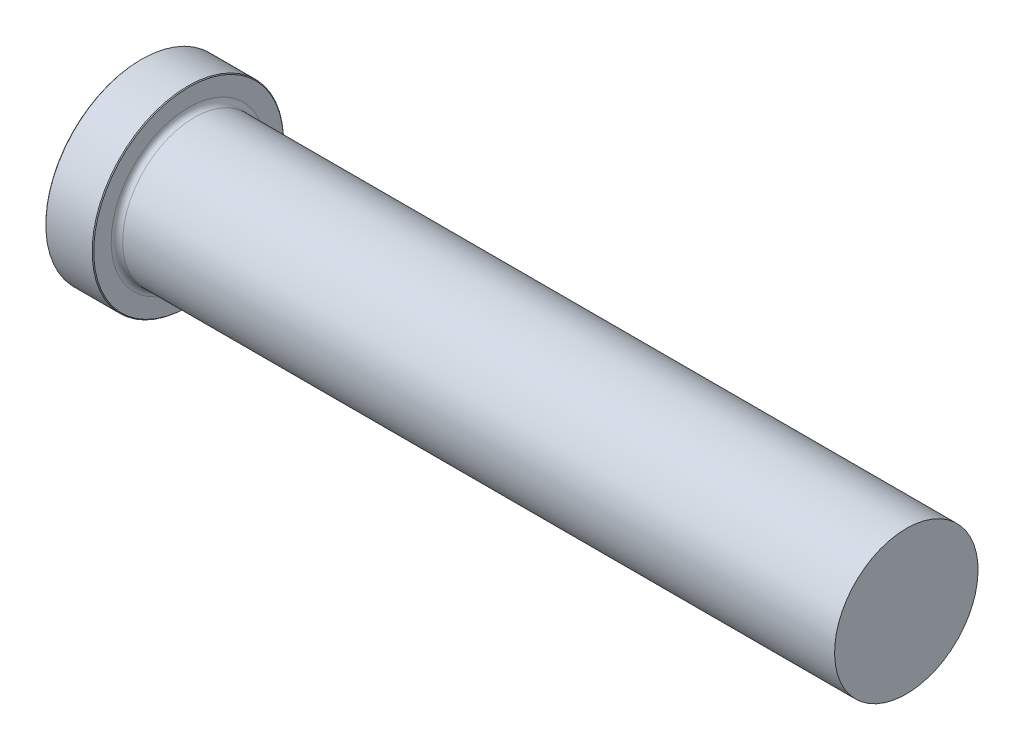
SolidWorks part; units mm, degrees
ref_plane "Front Plane" through (0, 0, 0) normal (0, 0, 1) x (1, 0, 0)
ref_plane "Top Plane" through (0, 0, 0) normal (0, 1, 0) x (1, 0, 0)
ref_plane "Right Plane" through (0, 0, 0) normal (1, 0, 0) x (0, 0, -1)
sketch "Sketch1" plane through (0, 0, 0) normal (0, 0, 1) x (1, 0, 0)
  line L0 (0, 0) -> (0, 12.7)
  line L1 (0, 12.7) -> (6.35, 12.7)
  line L2 (6.35, 12.7) -> (6.35, 10.2806)
  line L3 (7.112, 9.5186) -> (101.6, 9.5186)
  line L4 (101.6, 9.5186) -> (101.6, 0)
  line L5 (101.6, 0) -> (0, 0)
  line L6 (101.6, 0) -> (101.6, -9.5186) construction
  line L7 (101.6, -9.5186) -> (6.35, -9.5187) construction
  line L8 (0, 0) -> (0, -12.7) construction
  line L9 (0, -12.7) -> (6.35, -12.7) construction
  line L10 (6.35, -12.7) -> (6.35, -9.5187) construction
  arc A0 (6.35, 10.2806) -> (7.112, 9.5186) centre (7.112, 10.2806) ccw
  dimension "D4" = 0.762
  dimension "L" = 101.6
  dimension "D" = 19.0373
  dimension "H" = 25.4
  dimension "T" = 6.35
revolve "Revolve1" add sketch "Sketch1" angle 360 about L5
chamfer "Chamfer1" distance 0.1016 angle 45 2 edges at (0, 12.7, 0) (6.35, 12.7, 0)
